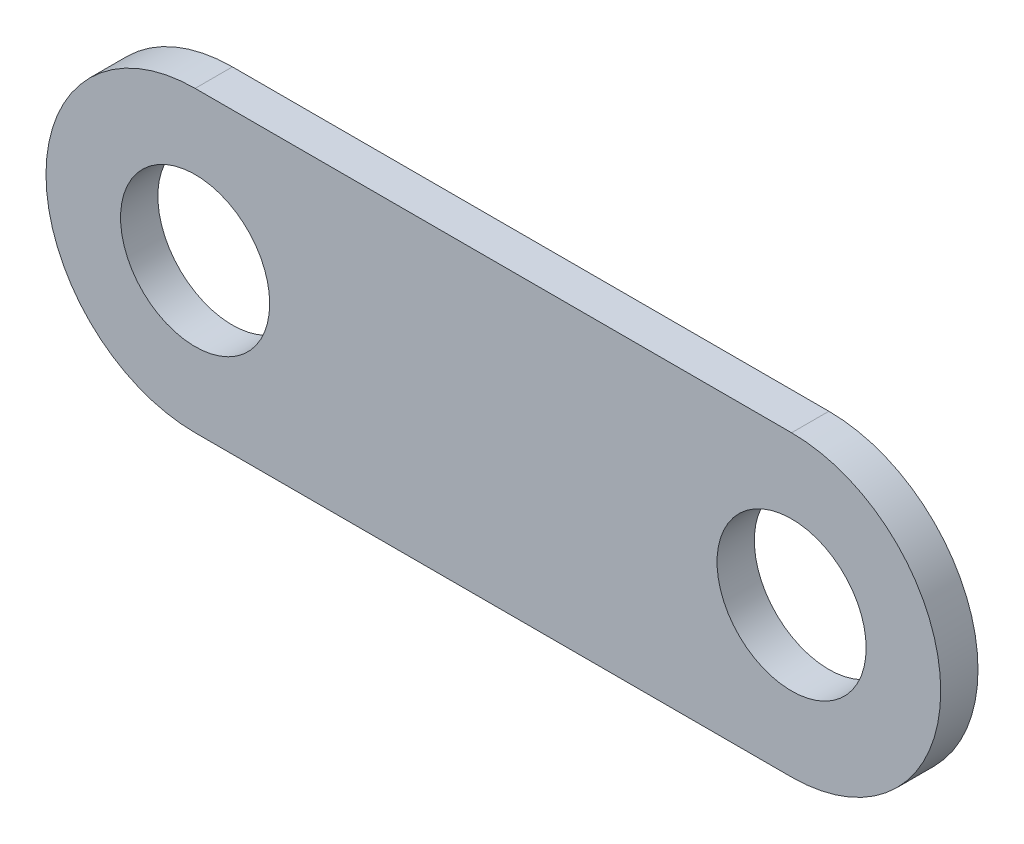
SolidWorks part; units mm, degrees
ref_plane "Front Plane" through (0, 0, 0) normal (0, 0, 1) x (1, 0, 0)
ref_plane "Top Plane" through (0, 0, 0) normal (0, 1, 0) x (1, 0, 0)
ref_plane "Right Plane" through (0, 0, 0) normal (1, 0, 0) x (0, 0, -1)
sketch "Sketch1" plane through (0, 0, 0) normal (0, 0, 1) x (1, 0, 0)
  line L0 (40, 20) -> (-40, 20)
  line L1 (-40, -20) -> (40, -20)
  line L2 (-40, 0) -> (40, 0) construction
  arc A0 (40, -20) -> (40, 20) centre (40, 0) ccw
  arc A1 (-40, 20) -> (-40, -20) centre (-40, 0) ccw
  dimension "D2" = 20
  dimension "D1" = 80
extrude "Boss-Extrude1" add sketch "Sketch1" along normal blind 5
sketch "Sketch2" plane through (0, 0, 5) normal (0, 0, 1) x (1, 0, 0)
  circle A0 centre (-40, 0) radius 10
  circle A1 centre (40, 0) radius 10
  dimension "D1" = 20
extrude "Cut-Extrude1" cut sketch "Sketch2" against normal through all
